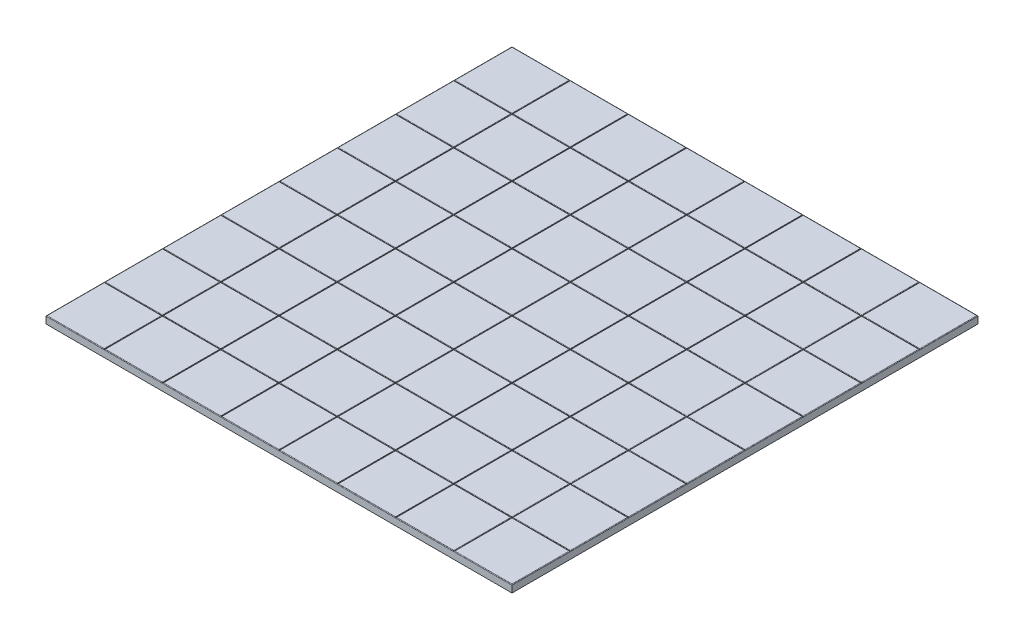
SolidWorks part; units mm, degrees
ref_plane "Front Plane" through (0, 0, 0) normal (0, 0, 1) x (1, 0, 0)
ref_plane "Top Plane" through (0, 0, 0) normal (0, 1, 0) x (1, 0, 0)
ref_plane "Right Plane" through (0, 0, 0) normal (1, 0, 0) x (0, 0, -1)
sketch "Sketch2" plane through (0, 0, 0) normal (0, 1, 0) x (1, 0, 0)
  line L1 (-1166.1316, -628.3949) -> (433.8684, -628.3949)
  line L2 (-1166.1316, -628.3949) -> (-1166.1316, 971.6051)
  line L3 (-1166.1316, 971.6051) -> (433.8684, 971.6051)
  line L4 (433.8684, -628.3949) -> (433.8684, 971.6051)
extrude "Boss-Extrude1" add sketch "Sketch2" against normal blind 25
ref_plane "Plane1" through (0, 0, 750) normal (0, 0, 1) x (1, 0, 0)
sketch "Sketch4" plane through (0, 0, 750) normal (0, 0, 1) x (1, 0, 0)
  line L3 (-1166.1316, 0) -> (433.8684, 0) construction
  line L6 (-1164.1316, 0) -> (-1166.1316, 0)
  line L7 (-1166.1316, 0) -> (-1166.1316, -2)
  arc A0 (-1164.1316, 0) -> (-1166.1316, -2) centre (-1164.1316, -2) ccw
  point P12 (-1166.1316, 0)
  dimension "D1" = 2
extrude "Cut-Extrude1" cut sketch "Sketch4" against normal blind 1800 contours L6 L7 A0
sketch "Sketch5" plane through (0, 0, 750) normal (0, 0, 1) x (1, 0, 0)
  line L0 (-1166.1316, 0.0028) -> (-1164.1298, 0.0028)
  line L1 (-1166.1316, -25) -> (-1166.1316, -2) construction
  line L2 (-968.2443, 0.0046) -> (-964.2443, 0.0046)
  line L3 (-1166.1316, -21.7818) -> (-1166.1316, -1.9972)
  line L4 (-568.0944, 0.0247) -> (-564.0944, 0.0247)
  line L5 (-768.2107, 0.0335) -> (-764.2107, 0.0335)
  line L6 (31.9678, 0.0183) -> (35.8674, 0.0183)
  line L8 (-368.1725, 0.007) -> (-364.1725, 0.007)
  line L9 (-167.9842, 0.0514) -> (-163.9842, 0.0514)
  line L10 (-1166.1316, -1.9972) -> (-1166.1316, 0.0028)
  line L11 (431.8684, 0) -> (433.8684, 0)
  line L12 (433.8684, -25) -> (433.8684, 0) construction
  line L15 (-1164.1316, 0) -> (433.8684, 0) construction
  line L16 (231.8684, 0) -> (235.8684, 0)
  arc A0 (433.8684, -2) -> (431.8684, 0) centre (431.8684, -2) ccw
  arc A1 (233.8684, -2) -> (231.8684, 0) centre (231.8684, -2) ccw
  arc A2 (233.8684, -2) -> (235.8684, 0) centre (235.8684, -2) cw
  arc A3 (33.9176, -1.981) -> (31.9678, 0.0183) centre (31.9176, -1.981) ccw
  arc A4 (33.9176, -1.981) -> (35.8674, 0.0183) centre (35.9176, -1.981) cw
  arc A5 (-366.1725, -1.993) -> (-368.1725, 0.007) centre (-368.1725, -1.993) ccw
  arc A6 (-366.1725, -1.993) -> (-364.1725, 0.007) centre (-364.1725, -1.993) cw
  arc A7 (-165.9842, -1.9486) -> (-167.9842, 0.0514) centre (-167.9842, -1.9486) ccw
  arc A8 (-165.9842, -1.9486) -> (-163.9842, 0.0514) centre (-163.9842, -1.9486) cw
  arc A9 (-1166.1316, -1.9972) -> (-1164.1298, 0.0028) centre (-1164.1316, -1.9972) cw
  arc A11 (-566.0944, -1.9753) -> (-568.0944, 0.0247) centre (-568.0944, -1.9753) ccw
  arc A12 (-566.0944, -1.9753) -> (-564.0944, 0.0247) centre (-564.0944, -1.9753) cw
  arc A15 (-766.2107, -1.9665) -> (-768.2107, 0.0335) centre (-768.2107, -1.9665) ccw
  arc A16 (-766.2107, -1.9665) -> (-764.2107, 0.0335) centre (-764.2107, -1.9665) cw
  arc A19 (-966.2443, -1.9954) -> (-968.2443, 0.0046) centre (-968.2443, -1.9954) ccw
  arc A20 (-966.2443, -1.9954) -> (-964.2443, 0.0046) centre (-964.2443, -1.9954) cw
  point P21 (433.8684, 0)
  point P28 (233.8684, 0)
  point P34 (33.9678, 0.0183)
  point P41 (33.8127, -6.7131)
  point P42 (-366.1725, 0.007)
  point P48 (-165.9842, 0.0514)
  point P63 (-566.0944, 0.0247)
  point P77 (-766.2107, 0.0335)
  point P91 (-966.2443, 0.0046)
  dimension "D1" = 2
  dimension "D2" = 2
  dimension "D3" = 2
  dimension "D4" = 2
  dimension "D5" = 2
  dimension "D6" = 2
  dimension "D7" = 2
  dimension "D9" = 2
  dimension "D11" = 2
extrude "Cut-Extrude5" cut sketch "Sketch5" against normal blind 1800 contours A19 A20 L2 | A15 A16 L5 | A11 A12 L4 | A5 A6 L8 | A7 A8 L9 | A3 A4 L6 | A1 A2 L16
sketch "Sketch8" plane through (0, 0, 628.3949) normal (0, 0, 1) x (1, 0, 0)
  line L0 (431.8684, 0) -> (433.8684, 0)
  line L1 (433.8684, 0) -> (433.8684, -2)
  arc A0 (433.8684, -2) -> (431.8684, 0) centre (431.8684, -2) ccw
  point P9 (433.8684, 0)
  dimension "D1" = 2
extrude "Cut-Extrude6" cut sketch "Sketch8" against normal blind 1800 contours L1 A0 L0
ref_plane "Plane3" through (550, 0, 0) normal (1, 0, 0) x (0, 0, -1)
sketch "Sketch13" plane through (550, 0, 0) normal (1, 0, 0) x (0, 0, -1)
  line L0 (969.6051, 0) -> (971.6051, 0)
  line L1 (-628.3949, 0) -> (-628.3949, -2)
  line L4 (971.6051, 0) -> (971.6051, -2)
  line L6 (-626.3949, 0) -> (-628.3949, 0)
  arc A0 (-626.3949, 0) -> (-628.3949, -2) centre (-626.3949, -2) ccw
  arc A1 (971.6051, -2) -> (969.6051, 0) centre (969.6051, -2) ccw
  point P10 (-628.3949, 0)
  point P15 (971.6051, 0)
  dimension "D1" = 2
  dimension "D2" = 2
extrude "Cut-Extrude9" cut sketch "Sketch13" against normal blind 1800
sketch "Sketch14" plane through (433.8684, 0, 0) normal (1, 0, 0) x (0, 0, -1)
  line L0 (-628.3949, -25) -> (-428.3949, -25)
  line L1 (-628.3949, -25) -> (971.6051, -25) construction
  line L2 (-430.3949, 0) -> (-426.3949, 0)
  arc A0 (-428.3949, -2) -> (-430.3949, 0) centre (-430.3949, -2) ccw
  arc A1 (-428.3949, -2) -> (-426.3949, 0) centre (-426.3949, -2) cw
  dimension "D1" = 2
  dimension "D2" = 2
extrude "Cut-Extrude10" cut sketch "Sketch14" against normal blind 1800 contours A0 A1 L2
sketch "Sketch15" plane through (550, 0, 0) normal (1, 0, 0) x (0, 0, -1)
  line L0 (-428.3949, -2) -> (-228.3949, -2)
  line L1 (971.6051, -2) -> (-428.3949, -2) construction
  line L2 (-30.3949, 0) -> (-26.3949, 0)
  line L3 (-230.3949, 0) -> (-226.3949, 0)
  line L4 (969.6051, 0) -> (-426.3949, 0) construction
  arc A0 (-228.3949, -2) -> (-230.3949, 0) centre (-230.3949, -2) ccw
  arc A1 (-226.3949, 0) -> (-228.3949, -2) centre (-226.3949, -2) ccw
  arc A2 (-28.3949, -2) -> (-30.3949, 0) centre (-30.3949, -2) ccw
  arc A3 (-26.3949, 0) -> (-28.3949, -2) centre (-26.3949, -2) ccw
  point P17 (-228.3949, 0)
  point P23 (-28.3949, 0)
  dimension "D1" = 2
  dimension "D2" = 2
  dimension "D3" = 2
  dimension "D4" = 2
extrude "Cut-Extrude11" cut sketch "Sketch15" against normal blind 1800 contours A3 L2 A2 | A1 L3 A0
sketch "Sketch16" plane through (550, 0, 0) normal (1, 0, 0) x (0, 0, -1)
  line L0 (169.6051, 0) -> (173.6051, 0)
  line L1 (971.6051, -2) -> (-28.3949, -2) construction
  line L4 (571.6051, -2) -> (771.6051, -2)
  line L5 (771.6051, -2) -> (971.6051, -2)
  line L6 (369.6051, 0) -> (373.6051, 0)
  line L7 (969.6051, 0) -> (-26.3949, 0) construction
  arc A0 (171.6051, -2) -> (169.6051, 0) centre (169.6051, -2) ccw
  arc A1 (173.6051, 0) -> (171.6051, -2) centre (173.6051, -2) ccw
  arc A2 (371.6051, -2) -> (369.6051, 0) centre (369.6051, -2) ccw
  arc A3 (373.6051, 0) -> (371.6051, -2) centre (373.6051, -2) ccw
  arc A4 (571.6051, -2) -> (569.6051, 0) centre (569.6051, -2) ccw
  arc A5 (573.6051, 0) -> (571.6051, -2) centre (573.6051, -2) ccw
  point P20 (171.6051, 0)
  point P25 (371.6051, 0)
  point P30 (571.6051, 0)
  dimension "D1" = 2
  dimension "D2" = 2
  dimension "D3" = 2
  dimension "D4" = 2
  dimension "D5" = 2
  dimension "D6" = 2
extrude "Cut-Extrude12" cut sketch "Sketch16" against normal blind 1800 contours A1 L0 A0 | A3 L6 A2
sketch "Sketch17" plane through (550, 0, 0) normal (1, 0, 0) x (0, 0, -1)
  line L0 (569.6051, 0) -> (573.6051, 0)
  line L1 (971.6051, -2) -> (371.6051, -2) construction
  line L2 (769.6051, 0) -> (773.6051, 0)
  line L4 (969.6051, 0) -> (373.6051, 0) construction
  arc A0 (571.6051, -2) -> (569.6051, 0) centre (569.6051, -2) ccw
  arc A1 (573.6051, 0) -> (571.6051, -2) centre (573.6051, -2) ccw
  arc A2 (771.6051, -2) -> (769.6051, 0) centre (769.6051, -2) ccw
  arc A3 (773.6051, 0) -> (771.6051, -2) centre (773.6051, -2) ccw
  point P17 (571.6051, 0)
  point P22 (771.6051, 0)
  dimension "D1" = 2
  dimension "D2" = 2
  dimension "D3" = 2
  dimension "D4" = 2
extrude "Cut-Extrude13" cut sketch "Sketch17" against normal blind 1800 contours L2 A3 A2 | L0 A1 A0
